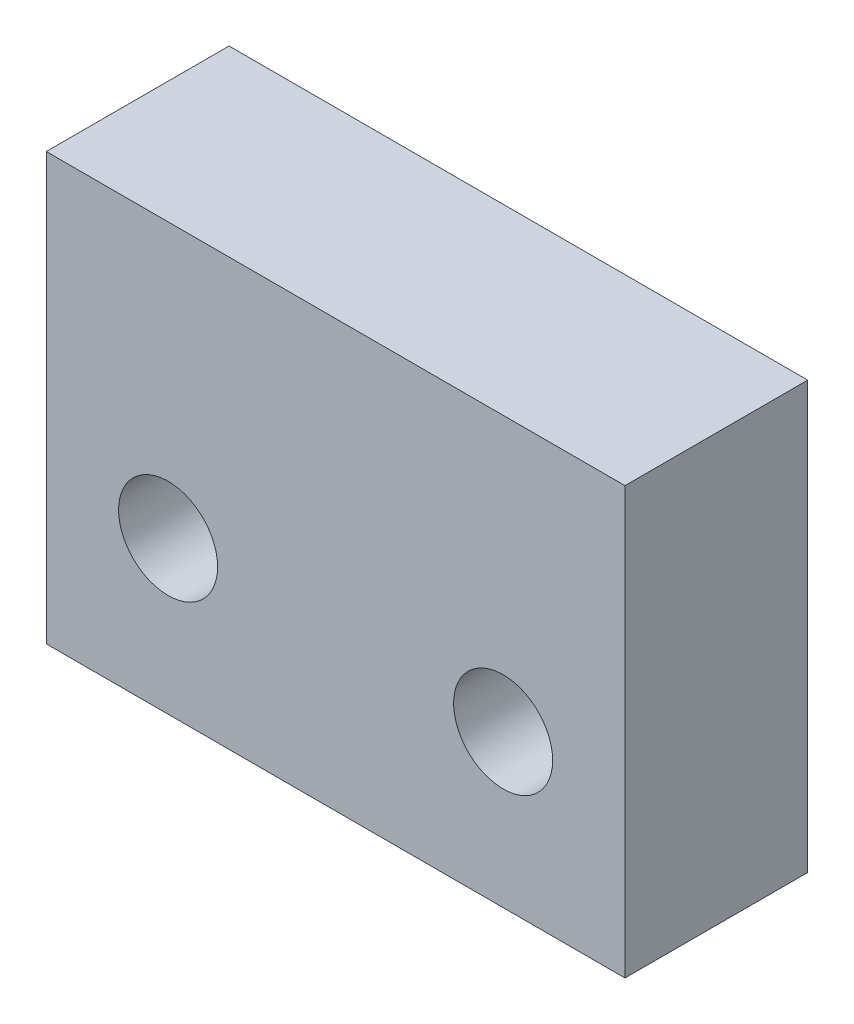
SolidWorks part; units mm, degrees
ref_plane "前视基准面" through (0, 0, 0) normal (0, 0, 1) x (1, 0, 0)
ref_plane "上视基准面" through (0, 0, 0) normal (0, 1, 0) x (1, 0, 0)
ref_plane "右视基准面" through (0, 0, 0) normal (1, 0, 0) x (0, 0, -1)
sketch "草图1" plane through (0, 0, 0) normal (0, 0, 1) x (1, 0, 0)
  line L0 (0, -28) -> (38, -28)
  line L1 (0, 0) -> (38, 0)
  line L2 (0, -28) -> (0, 0)
  line L3 (38, -28) -> (38, 0)
  circle A0 centre (8, -18) radius 3.25
  circle A1 centre (30, -18) radius 3.25
extrude "凸台-拉伸1" add sketch "草图1" along normal blind 12
